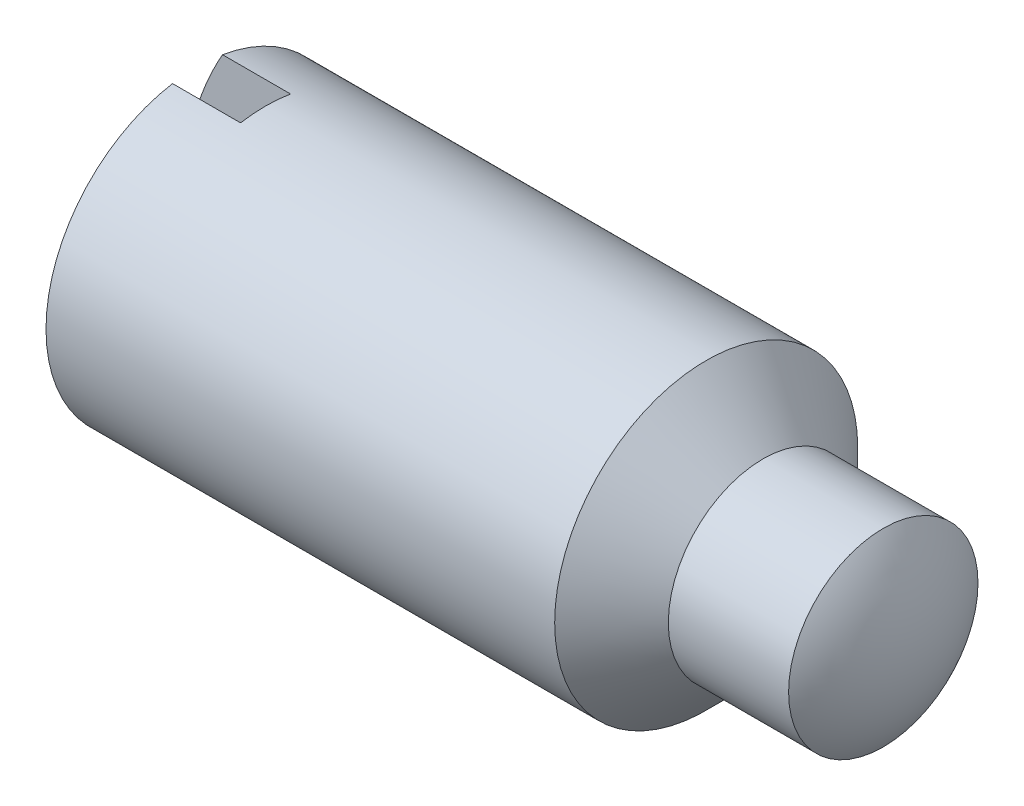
SolidWorks part; units mm, degrees
ref_plane "Front" through (0, 0, 0) normal (0, 0, 1) x (1, 0, 0)
ref_plane "Top" through (0, 0, 0) normal (0, 1, 0) x (1, 0, 0)
ref_plane "Right" through (0, 0, 0) normal (1, 0, 0) x (0, 0, -1)
sketch "Sketch1" plane through (11.1469, 0, 2) normal (0, 1, 0) x (1, 0, 0)
  line L0 (-1.1469, 2) -> (-11.1469, 2)
  line L2 (-1.5594, 3.25) -> (-3.1469, 3.25)
  line L3 (-3.1469, 3.25) -> (-3.8969, 4)
  line L4 (-3.8969, 4) -> (-10.611, 4)
  line L5 (-15.3263, 2) -> (1.8856, 2) construction
  arc A0 (-10.611, 4) -> (-11.1469, 2) centre (-7.1469, 2) ccw
  arc A1 (-1.1469, 2) -> (-1.5594, 3.25) centre (-3.2469, 2) ccw
  dimension "R" = 4
  dimension "D1" = 45
  dimension "re" = 2.1
  dimension "l" = 8
  dimension "d" = 4
  dimension "dp" = 2.5
  dimension "z" = 2
revolve "Base" add sketch "Sketch1" angle 360 about L5
sketch "Sketch2" plane through (0, 0, 0) normal (0, 1, 0) x (1, 0, 0)
  line L0 (-0.4638, 0) -> (0.2879, 0) construction
  line L1 (1.4336, 0.33) -> (0.0136, 0.33)
  line L2 (1.4336, 0.33) -> (1.4336, -0.33)
  line L3 (1.4336, -0.33) -> (0.0136, -0.33)
  arc A2 (0.5359, 2) -> (0.5359, -2) centre (4, 0) ccw construction
  arc A3 (0.0136, 0.33) -> (0.0136, -0.33) centre (0.0136, 0) ccw
  dimension "m" = 0.33
  dimension "n" = 0.66
  dimension "t" = 1.42
extrude "Slot" cut sketch "Sketch2" against normal through all and the other way through all
sketch "Sketch3" plane through (0, 0, 0) normal (0, 1, 0) x (1, 0, 0)
  line L0 (7.25, 1.567) -> (7.5, 2)
  line L1 (7.5, 2) -> (7.5, 2.5)
  line L2 (7.5, 2.5) -> (7, 2.5)
  line L3 (7, 2.5) -> (7, 2)
  line L4 (7, 2) -> (7.25, 1.567)
  line L5 (7.25, -2) -> (7.25, 2) construction
  line L6 (7.25, 2) -> (0.5359, 2) construction
  line L7 (0, 0) -> (11.0187, 0) construction
  dimension "D1" = 0.5
revolve "Cut-Revolve10" [suppressed] cut sketch "Sketch3" angle 360 about L7
pattern_linear "LPattern10" [suppressed] count 12 spacing 0.6 along (1, 0, 0)
equation "\"re@Sketch1\" = \"dp@Sketch1\" - \"Z@Sketch1\" / 5"
equation "\"m@Sketch2\" = \"n@Sketch2\" / 2"
equation "\"D1@Sketch3\" =  ( \"d@Sketch1\" - \"D2@ThreadCosmetic1\" )  / 2"
equation "\"D3@LPattern10\" = \"D1@Sketch3\" * 1.2"
equation "\"D1@LPattern10\" = ( \"l@Sketch1\" -  ( \"d@Sketch1\" - \"dp@Sketch1\" )  / 2 )  / \"D3@LPattern10\""
